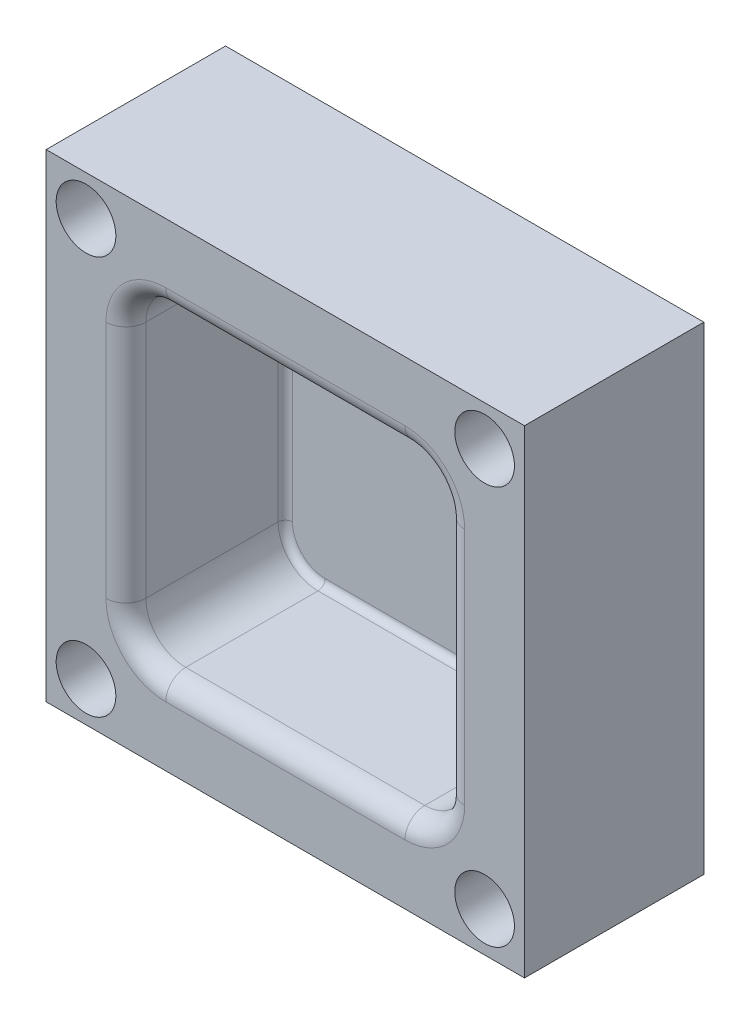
SolidWorks part; units mm, degrees
ref_plane "Plane1" through (0, 0, 0) normal (0, 0, 1) x (1, 0, 0)
ref_plane "Plane2" through (0, 0, 0) normal (0, 1, 0) x (1, 0, 0)
ref_plane "Plane3" through (0, 0, 0) normal (1, 0, 0) x (0, 0, -1)
sketch "Sketch1" plane through (0, 0, 0) normal (0, 0, 1) x (1, 0, 0)
  line L0 (-38.1, 38.1) -> (38.1, 38.1)
  line L1 (-38.1, 38.1) -> (-38.1, -38.1)
  line L2 (38.1, -38.1) -> (-38.1, -38.1)
  line L3 (38.1, -38.1) -> (38.1, 38.1)
  dimension "D1" = 38.1
  dimension "D2" = 38.1
  dimension "D3" = 38.1
  dimension "D4" = 38.1
extrude "Base-Extrude" add sketch "Sketch1" along normal blind 28.575
sketch "Sketch2" plane through (0, 0, 28.575) normal (0, 0, 1) x (1, 0, 0)
  line L4 (-25.4, 25.4) -> (-25.4, -25.4)
  line L5 (-25.4, -25.4) -> (25.4, -25.4)
  line L6 (25.4, -25.4) -> (25.4, 25.4)
  line L7 (25.4, 25.4) -> (-25.4, 25.4)
  line L8 (-25.4, 19.05) -> (-25.4, -19.05)
  line L9 (-19.05, -25.4) -> (19.05, -25.4)
  line L10 (25.4, -19.05) -> (25.4, 19.05)
  line L11 (19.05, 25.4) -> (-19.05, 25.4)
  arc A0 (-19.05, 25.4) -> (-25.4, 19.05) centre (-19.05, 19.05) ccw
  arc A1 (19.05, 25.4) -> (25.4, 19.05) centre (19.05, 19.05) cw
  arc A2 (25.4, -19.05) -> (19.05, -25.4) centre (19.05, -19.05) cw
  arc A3 (-19.05, -25.4) -> (-25.4, -19.05) centre (-19.05, -19.05) cw
  dimension "D2" = 6.35
  dimension "D1" = 12.7
extrude "Cut-Extrude1" cut sketch "Sketch2" against normal blind 25.4
sketch "Sketch3" plane through (0, 0, 28.575) normal (0, 0, 1) x (1, 0, 0)
  line L0 (-38.1, 38.1) -> (-38.1, -38.1) construction
  line L1 (-38.1, 38.1) -> (38.1, 38.1) construction
  circle A0 centre (-31.75, 31.75) radius 2.3779
  dimension "D1" = 6.35
  dimension "D2" = 6.35
extrude "Cut-Extrude2" cut sketch "Sketch3" against normal blind 28.575
pattern_linear "LPattern1" count 2 spacing 63.5 count 2 spacing 63.5
sketch "Sketch4" plane through (0, 0, 28.575) normal (0, 0, 1) x (1, 0, 0)
  circle A1 centre (-31.75, 31.75) radius 4.7528
  circle A2 centre (-31.75, 31.75) radius 4.7528
  circle A3 centre (31.75, 31.75) radius 4.7528
  circle A4 centre (31.75, 31.75) radius 4.7528
  circle A5 centre (-31.75, -31.75) radius 4.7528
  circle A6 centre (-31.75, -31.75) radius 4.7528
  circle A7 centre (31.75, -31.75) radius 4.7528
  circle A8 centre (31.75, -31.75) radius 4.7528
  dimension "D1" = 2.3749
  dimension "D2" = 2.3749
  dimension "D3" = 2.3749
  dimension "D4" = 2.3749
extrude "Cut-Extrude3" cut sketch "Sketch4" against normal blind 9.525
fillet "Fillet1" radius 1.143
fillet "Fillet2" radius 3.175
